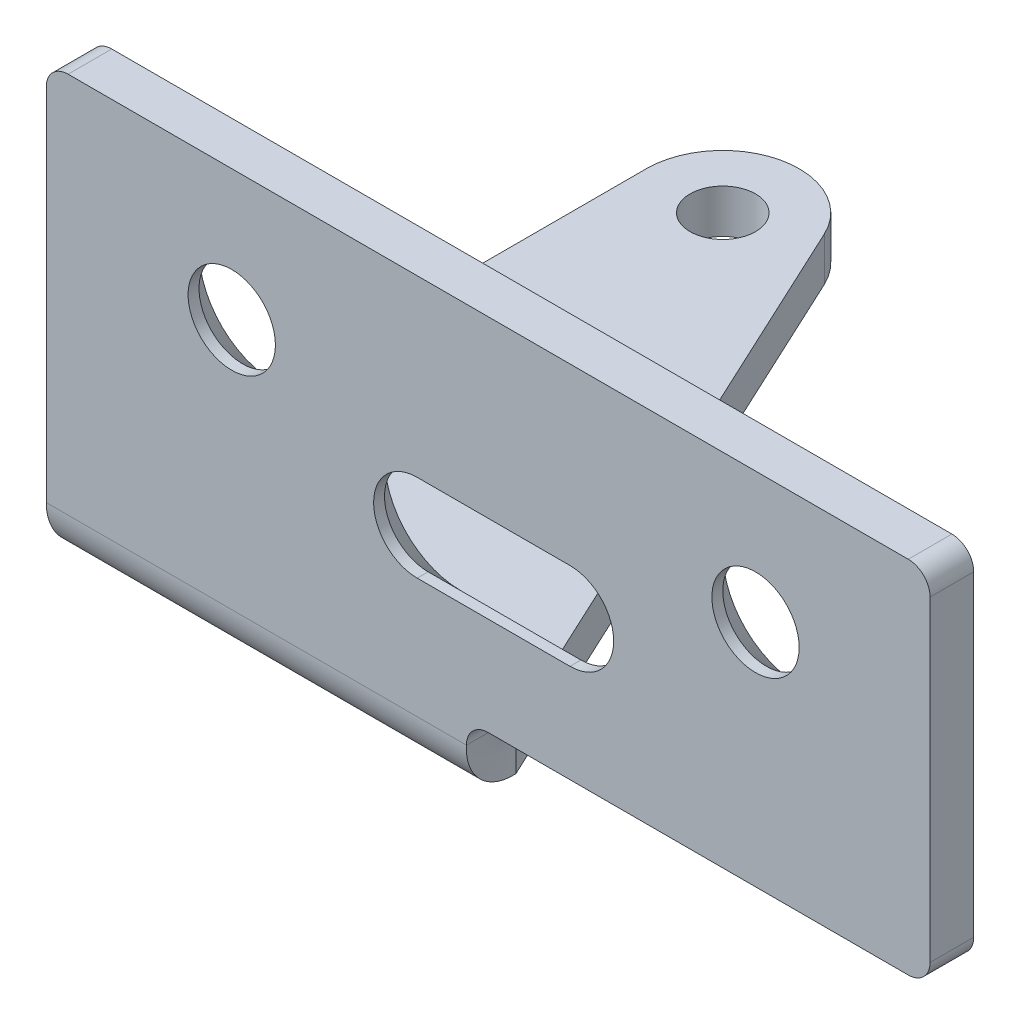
SolidWorks part; units mm, degrees
other "<_蝶番A-1>-<ﾌﾞﾚｰｸ - ｺｰﾅｰ1>"
ref_plane "正面" through (0, 0, 0) normal (0, 0, 1) x (1, 0, 0)
ref_plane "平面" through (0, 0, 0) normal (0, 1, 0) x (1, 0, 0)
ref_plane "右側面" through (0, 0, 0) normal (1, 0, 0) x (0, 0, -1)
mirrored part "_蝶番A-1_ﾐﾗｰ ｺﾋﾟｰ"
